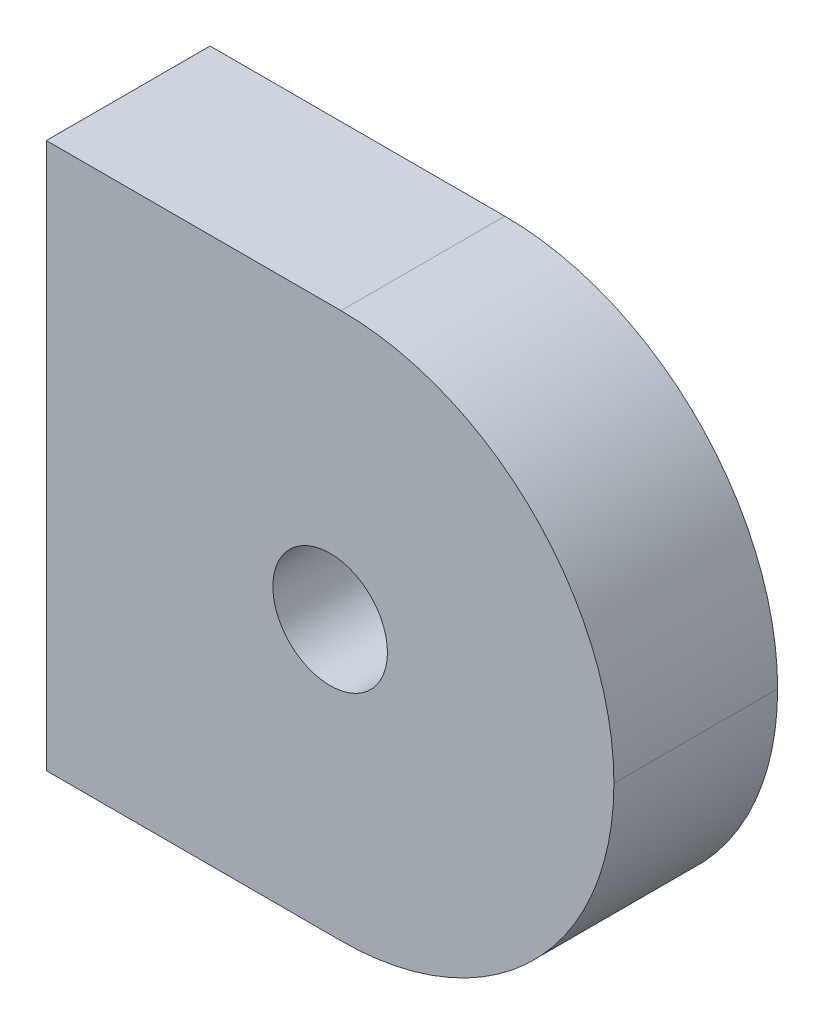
SolidWorks part; units mm, degrees
ref_plane "Plan de face" through (0, 0, 0) normal (0, 0, 1) x (1, 0, 0)
ref_plane "Plan de dessus" through (0, 0, 0) normal (0, 1, 0) x (1, 0, 0)
ref_plane "Plan de droite" through (0, 0, 0) normal (1, 0, 0) x (0, 0, -1)
sketch "Esquisse1" plane through (0, 0, 0) normal (0, 0, 1) x (1, 0, 0)
  line L1 (-40, 30) -> (-19.2, 30)
  line L2 (-40, 30) -> (-40, 10)
  line L3 (-40, 10) -> (-19.2, 10)
  line L4 (-19.2, 30) -> (-19.2, 10)
  dimension "D1" = 20.8
  dimension "D2" = 20
extrude "Extrusion1" add sketch "Esquisse1" along normal blind 6
sketch "Esquisse2" plane through (0, 0, 6) normal (0, 0, 1) x (1, 0, 0)
  line L1 (-40, 30) -> (-40, 10) construction
  line L2 (-19.2, 30) -> (-40, 30) construction
  circle A0 centre (-29.6, 20) radius 2.1
  dimension "D1" = 4.2
  dimension "D2" = 10.4
  dimension "D3" = 10
extrude "Enlèv. mat.-Extru.1" cut sketch "Esquisse2" against normal blind 6
fillet "Congé1" radius 10 4 edges at (-19.2, 20, 6) (-19.2, 20, 0) (-19.2, 30, 3) (-19.2, 10, 3)
sketch "Esquisse3" plane through (0, 0, 0) normal (0, 0, -1) x (-1, 0, 0)
  line L1 (33.3528, 20) -> (31.4764, 23.25)
  line L2 (31.4764, 23.25) -> (27.7236, 23.25)
  line L3 (27.7236, 23.25) -> (25.8472, 20)
  line L4 (25.8472, 20) -> (27.7236, 16.75)
  line L5 (27.7236, 16.75) -> (31.4764, 16.75)
  line L6 (31.4764, 16.75) -> (33.3528, 20)
  circle A0 centre (29.6, 20) radius 3.25 construction
  dimension "D1" = 6.5
extrude "Enlèv. mat.-Extru.2" cut sketch "Esquisse3" against normal blind 1.45
